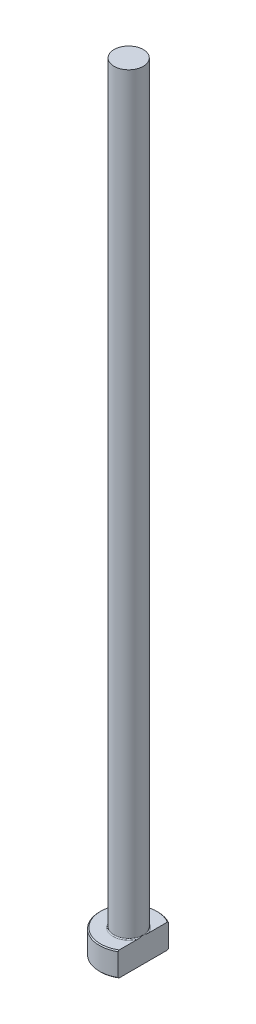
SolidWorks part; units mm, degrees
ref_plane "Front Plane" through (0, 0, 0) normal (0, 0, 1) x (1, 0, 0)
ref_plane "Top Plane" through (0, 0, 0) normal (0, 1, 0) x (1, 0, 0)
ref_plane "Right Plane" through (0, 0, 0) normal (1, 0, 0) x (0, 0, -1)
sketch "Sketch1" plane through (0, 0, 0) normal (0, 0, 1) x (1, 0, 0)
  line L0 (0, 259.9588) -> (0, -15.1925) construction
  line L1 (0, 0) -> (-6, 0)
  line L2 (-6, 0) -> (-6, 5)
  line L3 (-6, 5) -> (-3, 5)
  line L4 (-3, 5) -> (-3, 160)
  line L5 (-3, 160) -> (0, 160)
  line L6 (0, 160) -> (0, 0)
  dimension "L" = 160
  dimension "H" = 12
  dimension "T" = 5
  dimension "D" = 6
revolve "Revolve1" add sketch "Sketch1" angle 360 about L0
chamfer "Chamfer1" distance 0.2 angle 45 2 edges at (0, 5, 6) (0, 0, 6)
fillet "Fillet1" radius 0.2 1 edges at (0, 5, 3)
sketch "Sketch2" plane through (0, 0, 0) normal (0, 1, 0) x (1, 0, 0)
  line L0 (3, 5.1962) -> (3, -5.1962)
  circle A0 centre (0, 0) radius 6 construction
  arc A1 (3, -5.1962) -> (3, 5.1962) centre (0, 0) ccw
  circle A2 centre (0, 0) radius 3 construction
extrude "KEY" cut sketch "Sketch2" along normal through all
